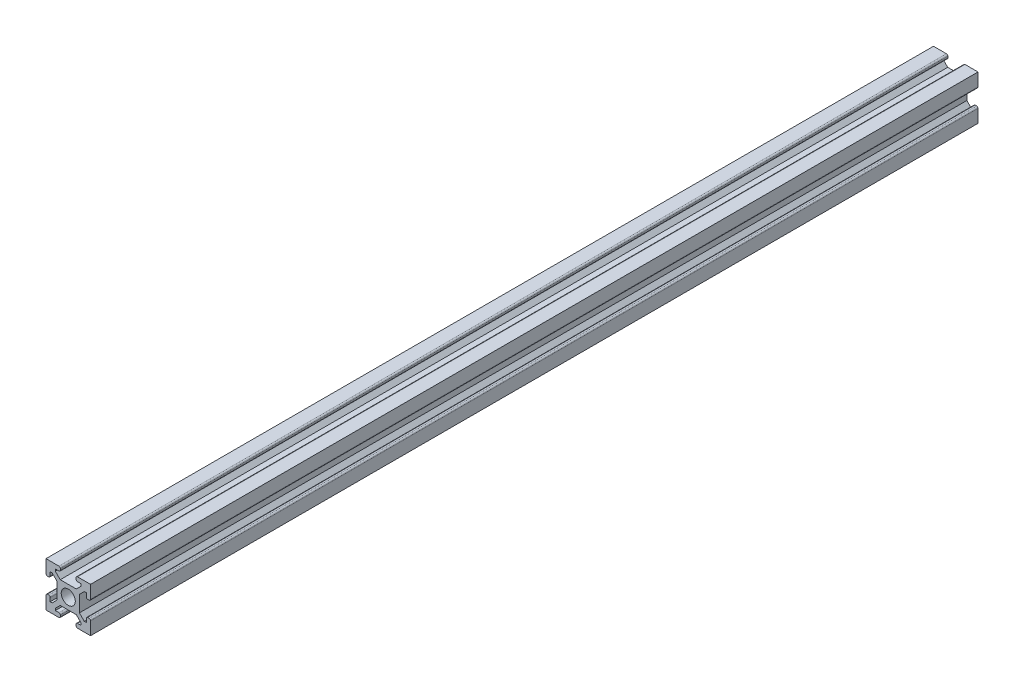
SolidWorks part; units mm, degrees
ref_plane "Front Plane" through (0, 0, 0) normal (0, 0, 1) x (1, 0, 0)
ref_plane "Top Plane" through (0, 0, 0) normal (0, 1, 0) x (1, 0, 0)
ref_plane "Right Plane" through (0, 0, 0) normal (1, 0, 0) x (0, 0, -1)
sketch "Sketch1" plane through (0, 0, 0) normal (0, 0, 1) x (1, 0, 0)
  line L0 (7.1042, 20.066) -> (7.1042, 16.256)
  line L1 (-20.066, 20.066) -> (20.066, 20.066)
  line L2 (-20.066, 20.066) -> (-20.066, -20.066)
  line L3 (-20.066, -20.066) -> (20.066, -20.066)
  line L4 (20.066, 20.066) -> (20.066, -20.066)
  line L5 (-20.066, 20.066) -> (20.066, -20.066) construction
  line L6 (-20.066, -20.066) -> (20.066, 20.066) construction
  line L7 (-10.033, 10.033) -> (10.033, 10.033)
  line L8 (-10.033, 10.033) -> (-10.033, -10.033)
  line L9 (-10.033, -10.033) -> (10.033, -10.033)
  line L10 (10.033, 10.033) -> (10.033, -10.033)
  line L11 (-10.033, 10.033) -> (10.033, -10.033) construction
  line L12 (-10.033, -10.033) -> (10.033, 10.033) construction
  line L13 (7.1042, 16.256) -> (11.6762, 16.256)
  line L14 (10.033, 7.2312) -> (14.478, 11.6762)
  line L15 (14.478, 11.6762) -> (16.256, 11.6762)
  line L16 (7.2312, 10.033) -> (11.6762, 14.478)
  line L17 (11.6762, 14.478) -> (11.6762, 16.256)
  line L18 (16.256, 7.1042) -> (16.256, 11.6762)
  line L19 (20.066, 7.1042) -> (16.256, 7.1042)
  line L20 (0, 20.066) -> (0, -20.066) construction
  line L21 (-20.066, 0) -> (20.066, 0) construction
  line L22 (-14.478, 11.6762) -> (-16.256, 11.6762)
  line L23 (-20.066, 7.1042) -> (-16.256, 7.1042)
  line L24 (-16.256, 7.1042) -> (-16.256, 11.6762)
  line L25 (-10.033, 7.2312) -> (-14.478, 11.6762)
  line L26 (-7.2312, 10.033) -> (-11.6762, 14.478)
  line L27 (-11.6762, 14.478) -> (-11.6762, 16.256)
  line L28 (-7.1042, 16.256) -> (-11.6762, 16.256)
  line L29 (-7.1042, 20.066) -> (-7.1042, 16.256)
  line L30 (20.066, -7.1042) -> (16.256, -7.1042)
  line L31 (16.256, -7.1042) -> (16.256, -11.6762)
  line L32 (14.478, -11.6762) -> (16.256, -11.6762)
  line L33 (10.033, -7.2312) -> (14.478, -11.6762)
  line L34 (7.2312, -10.033) -> (11.6762, -14.478)
  line L35 (11.6762, -14.478) -> (11.6762, -16.256)
  line L36 (7.1042, -16.256) -> (11.6762, -16.256)
  line L37 (7.1042, -20.066) -> (7.1042, -16.256)
  line L38 (-7.1042, -20.066) -> (-7.1042, -16.256)
  line L39 (-7.1042, -16.256) -> (-11.6762, -16.256)
  line L40 (-11.6762, -14.478) -> (-11.6762, -16.256)
  line L41 (-7.2312, -10.033) -> (-11.6762, -14.478)
  line L42 (-14.478, -11.6762) -> (-16.256, -11.6762)
  line L43 (-10.033, -7.2312) -> (-14.478, -11.6762)
  line L44 (-16.256, -7.1042) -> (-16.256, -11.6762)
  line L45 (-20.066, -7.1042) -> (-16.256, -7.1042)
  circle A0 centre (0, 0) radius 6.35
  point P0 (0, 0)
  point P6 (0, 0)
  point P16 (11.6762, 15.367)
  point P20 (15.367, 11.6762)
  dimension "D4" = 3.81
  dimension "D1" = 40.132
  dimension "D2" = 40.132
  dimension "D3" = 20.066
  dimension "D5" = 4.572
  dimension "D6" = 1.778
extrude "Boss-Extrude1" add sketch "Sketch1" along normal blind 800.0009 contours L29 L1 L2 L23 L24 L22 L25 L8 L7 L26 L27 L28 | L10 L7 L8 L9 A0 | L19 L4 L1 L0 L13 L17 L16 L7 L10 L14 L15 L18 | L45 L2 L3 L38 L39 L40 L41 L9 L8 L43 L42 L44 | L37 L3 L4 L30 L31 L32 L33 L10 L9 L34 L35 L36
fillet "Fillet1" radius 1.27 16 edges at (7.1042, -16.256, 400.0005) (7.1042, -20.066, 400.0005) (-20.066, 7.1042, 400.0005) (-16.256, 7.1042, 400.0005) (-20.066, -7.1042, 400.0005) (-16.256, -7.1042, 400.0005) (-7.1042, -20.066, 400.0005) (-7.1042, -16.256, 400.0005) (16.256, -7.1042, 400.0005) (20.066, -7.1042, 400.0005) (20.066, 7.1042, 400.0005) (16.256, 7.1042, 400.0005) (7.1042, 16.256, 400.0005) (7.1042, 20.066, 400.0005) (-7.1042, 16.256, 400.0005) (-7.1042, 20.066, 400.0005)
